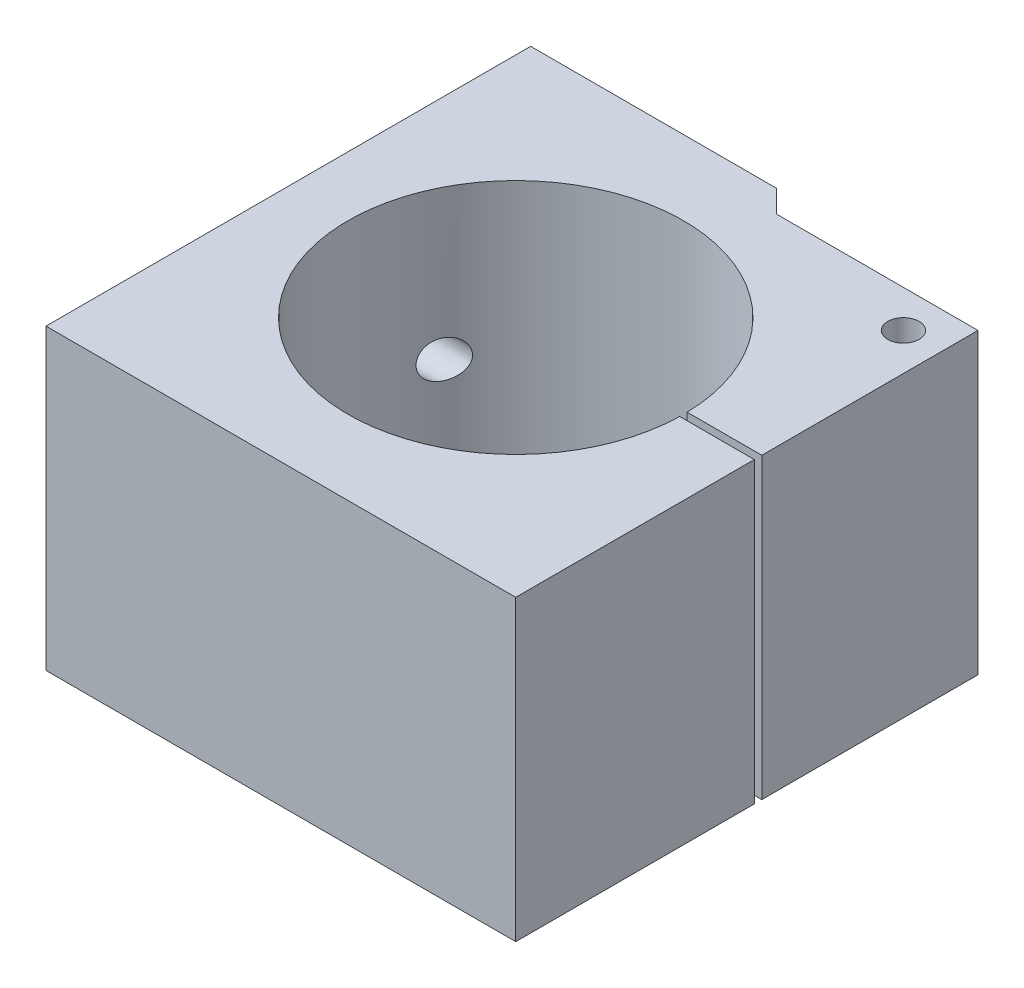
SolidWorks part; units mm, degrees
ref_plane "Front Plane" through (0, 0, 0) normal (0, 0, 1) x (1, 0, 0)
ref_plane "Top Plane" through (0, 0, 0) normal (0, 1, 0) x (1, 0, 0)
ref_plane "Right Plane" through (0, 0, 0) normal (1, 0, 0) x (0, 0, -1)
sketch "Sketch1" plane through (0, 0, 0) normal (0, 1, 0) x (1, 0, 0)
  line L1 (-32.5, -32.5) -> (32.5, -32.5)
  line L2 (-32.5, -32.5) -> (-32.5, 32.5)
  line L3 (-32.5, 32.5) -> (32.5, 32.5)
  line L4 (32.5, -32.5) -> (32.5, 32.5)
  line L5 (-32.5, -32.5) -> (32.5, 32.5) construction
  line L6 (-32.5, 32.5) -> (32.5, -32.5) construction
  point P0 (0, 0)
  dimension "D1" = 65
extrude "Boss-Extrude1" add sketch "Sketch1" along normal blind 40
sketch "Sketch2" plane through (0, 40, 0) normal (0, 1, 0) x (1, 0, 0)
  circle A0 centre (0, 0) radius 22.5
  dimension "D1" = 45
extrude "Cut-Extrude1" cut sketch "Sketch2" against normal up to next
sketch "Sketch3" plane through (32.5, 0, 0) normal (1, 0, 0) x (0, 0, -1)
  line L0 (0, 40) -> (0, 0) construction
  line L1 (-32.5, 40) -> (32.5, 40) construction
  line L2 (-32.5, 0) -> (32.5, 0) construction
  line L3 (-0.5, 40) -> (-0.5, 0)
  line L4 (-0.5, 0) -> (0.5, 0)
  line L5 (0.5, 0) -> (0.5, 40)
  line L6 (0.5, 40) -> (-0.5, 40)
  dimension "D1" = 0.5
  dimension "D2" = 1
extrude "Cut-Extrude2" cut sketch "Sketch3" against normal up to next
sketch "Sketch5" plane through (-32.5, 0, 0) normal (-1, 0, 0) x (0, 0, 1)
  line L0 (-32.5, 0) -> (32.5, 0) construction
  line L1 (32.5, 40) -> (32.5, 0) construction
  line L2 (-32.5, 40) -> (32.5, 40) construction
  line L3 (-32.5, 40) -> (-32.5, 0) construction
  line L4 (-32.5, 0) -> (32.5, 0)
  line L5 (32.5, 40) -> (32.5, 0)
  line L6 (-32.5, 40) -> (32.5, 40)
  line L7 (-32.5, 40) -> (-32.5, 0)
extrude "Cut-Extrude3" cut sketch "Sketch5" against normal blind 5
sketch "Sketch7" plane through (0, 0, -32.5) normal (0, 0, -1) x (-1, 0, 0)
  line L0 (-32.5, 0) -> (27.5, 0) construction
  line L1 (-32.5, 40) -> (-12.5, 40)
  line L2 (-32.5, 40) -> (-32.5, 0)
  line L3 (-32.5, 0) -> (-12.5, 0)
  line L4 (-12.5, 40) -> (-12.5, 0)
  dimension "D1" = 20
extrude "Cut-Extrude4" cut sketch "Sketch7" against normal blind 3
chamfer "Chamfer1" distance 10 angle 45 1 edges at (12.5, 20, -32.5)
sketch "Sketch8" plane through (0, 0, -29.5) normal (0, 0, -1) x (-1, 0, 0)
  line L0 (-32.5, 0) -> (-5.5, 0) construction
  line L1 (-32.5, 40) -> (-32.5, 0) construction
  circle A0 centre (-19.5, 10) radius 5
  dimension "D3" = 10
  dimension "D1" = 10
  dimension "D2" = 13
extrude "Boss-Extrude2" add sketch "Sketch8" along normal blind 20
sketch "Sketch9" plane through (0, 0, -29.5) normal (0, 0, -1) x (-1, 0, 0)
  line L0 (-5.5, 0) -> (-5.5, 40) construction
  line L1 (-5.5, 40) -> (-32.5, 40) construction
  line L2 (-5.5, 0) -> (-5.5, 40)
  line L3 (-5.5, 40) -> (-32.5, 40)
  circle A0 centre (-13.5, 32) radius 5
  dimension "D1" = 10
  dimension "D2" = 8
  dimension "D3" = 8
extrude "Cut-Extrude5" cut sketch "Sketch9" against normal blind 7.5 contours A0
sketch "Sketch10" plane through (0, 40, 0) normal (0, 1, 0) x (1, 0, 0)
  line L0 (32.5, 0.5) -> (32.5, 29.5) construction
  line L1 (5.5, 29.5) -> (32.5, 29.5) construction
  circle A0 centre (27.5, 24.5) radius 2.1
  dimension "D1" = 4.2
  dimension "D2" = 5
  dimension "D3" = 5
extrude "Cut-Extrude6" cut sketch "Sketch10" against normal blind 10
sketch "Sketch12" plane through (-27.5, 0, 0) normal (-1, 0, 0) x (0, 0, 1)
  line L0 (0, 40) -> (0, 0) construction
  line L1 (32.5, 40) -> (-32.5, 40) construction
  line L2 (-32.5, 0) -> (32.5, 0) construction
  line L3 (-10.25, 20) -> (0, 20) construction
  line L5 (0, 20) -> (10.25, 20) construction
  circle A0 centre (-10.25, 20) radius 2.5
  circle A1 centre (10.25, 20) radius 2.5
  dimension "D1" = 5
  dimension "D2" = 10.25
extrude "Cut-Extrude8" cut sketch "Sketch12" against normal blind 10
sketch "Sketch13" plane through (-27.5, 0, 0) normal (-1, 0, 0) x (0, 0, 1)
  line L4 (-32.5, 40) -> (-32.5, 0)
  line L5 (-32.5, 0) -> (32.5, 0)
  line L6 (32.5, 0) -> (32.5, 40)
  line L7 (32.5, 40) -> (-32.5, 40)
  line L8 (-32.5, 40) -> (-32.5, 0)
  line L9 (-32.5, 0) -> (32.5, 0)
  line L10 (32.5, 0) -> (32.5, 40)
  line L11 (32.5, 40) -> (-32.5, 40)
  circle A0 centre (-10.25, 20) radius 2.5 construction
  circle A1 centre (10.25, 20) radius 2.5 construction
  circle A2 centre (-10.25, 20) radius 2.5
  circle A3 centre (10.25, 20) radius 2.5
  dimension "D1" = 0
extrude "Boss-Extrude3" add sketch "Sketch13" along normal blind 3
sketch "Sketch11" plane through (0, 0, -49.5) normal (0, 0, -1) x (-1, 0, 0)
  circle A0 centre (-19.5, 10) radius 5 construction
  circle A1 centre (-19.5, 10) radius 5
extrude "Cut-Extrude7" cut sketch "Sketch11" against normal up to surface (27.5 mm away)
